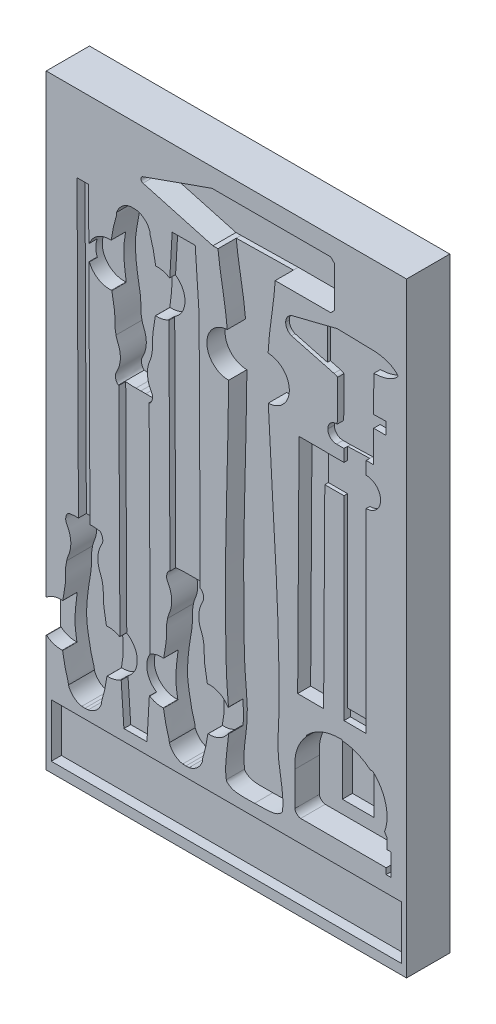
SolidWorks part; units mm, degrees
other "Caméra1"
ref_plane "Front" through (0, 0, 0) normal (0, 0, 1) x (1, 0, 0)
ref_plane "Top" through (0, 0, 0) normal (0, 1, 0) x (1, 0, 0)
ref_plane "Right" through (0, 0, 0) normal (1, 0, 0) x (0, 0, -1)
sketch "Esquisse1" plane through (0, 0, 0) normal (0, 0, 1) x (1, 0, 0)
  line L1 (0, 0) -> (250, 0)
  line L2 (0, 0) -> (0, 420)
  line L3 (0, 420) -> (250, 420)
  line L4 (250, 0) -> (250, 420)
  dimension "D1" = 250
  dimension "D2" = 420
extrude "Boss.-Extru.1" add sketch "Esquisse1" along normal blind 30
other "Empreinte1"
other "facom-205C-80<2>@insert-1-assemblage1"
other "Empreinte2"
other "pied-a-coulisse-mitutoyo<1>@insert-1-assemblage1"
other "Empreinte4"
other "marqueur<1>@insert-1-assemblage2"
sketch "Esquisse2" plane through (0, 0, 30) normal (0, 0, 1) x (1, 0, 0)
  line L0 (206.5781, 296.4978) -> (206.5781, 132.9577) construction
  line L1 (206.5781, 288.0694) -> (188.7435, 288.0694)
  line L2 (206.5781, 288.0694) -> (206.5781, 268.0694)
  line L3 (206.5781, 268.0694) -> (188.7435, 268.0694)
  line L4 (188.7435, 288.0694) -> (188.7435, 268.0694)
  line L7 (193.4076, 288.0409) -> (175.4079, 288.1507) construction
  dimension "D1" = 20
extrude "Enlèv. mat.-Extru.2" cut sketch "Esquisse2" against normal up to surface (2.5 mm away)
sketch "Esquisse3" plane through (0, 0, 30) normal (0, 0, 1) x (1, 0, 0)
  line L0 (222, 132.8636) -> (222, 296.9686) construction
  line L1 (206.5781, 288.0694) -> (188.7435, 288.0694) construction
  line L2 (222, 288.0694) -> (222, 268.0694)
  arc A0 (222, 268.0694) -> (222, 288.0694) centre (222, 278.0694) ccw
  dimension "D2" = 20
  dimension "D1" = 10
extrude "Enlèv. mat.-Extru.3" cut sketch "Esquisse3" against normal up to surface (2.5 mm away)
other "Empreinte5"
other "metre-facom-3m<1>@insert-1-assemblage1"
sketch "Esquisse4" plane through (0, 0, 30) normal (0, 0, 1) x (1, 0, 0)
  line L0 (192.4621, 133.0438) -> (193.2858, 268.0694) construction
  line L1 (175.4079, 288.1507) -> (193.4083, 288.1507)
  line L2 (175.4079, 288.1507) -> (174.4624, 133.1536)
  line L3 (174.4624, 133.1536) -> (192.4621, 133.0438)
  line L4 (193.4083, 288.1507) -> (192.4621, 133.0438)
extrude "Enlèv. mat.-Extru.4" cut sketch "Esquisse4" against normal blind 9
other "Empreinte7"
other "sencys-limes-ronde<3>@insert-1-assemblage1"
other "sencys-limes-plate<4>@insert-1-assemblage1"
other "sencys-limes-arrondie<4>@insert-1-assemblage1"
other "Empreinte8"
other "metre-rigide<1>@insert-1-assemblage2"
fillet "Congé1" radius 0.2 24 edges at (0, 103.7178, 25) (0, 81.3633, 25) (126.5327, 100.1414, 25) (126.6392, 85.8121, 25) (51.9863, 80.2349, 27.625) (71.55, 80.4871, 27.625) (72.1411, 105.6536, 27.625) (51.1421, 105.3935, 27.625) (85.1392, 313.0661, 28) (85.7304, 338.2325, 28) (29.5552, 330.3157, 27.25) (29.5991, 321.228, 27.25)
